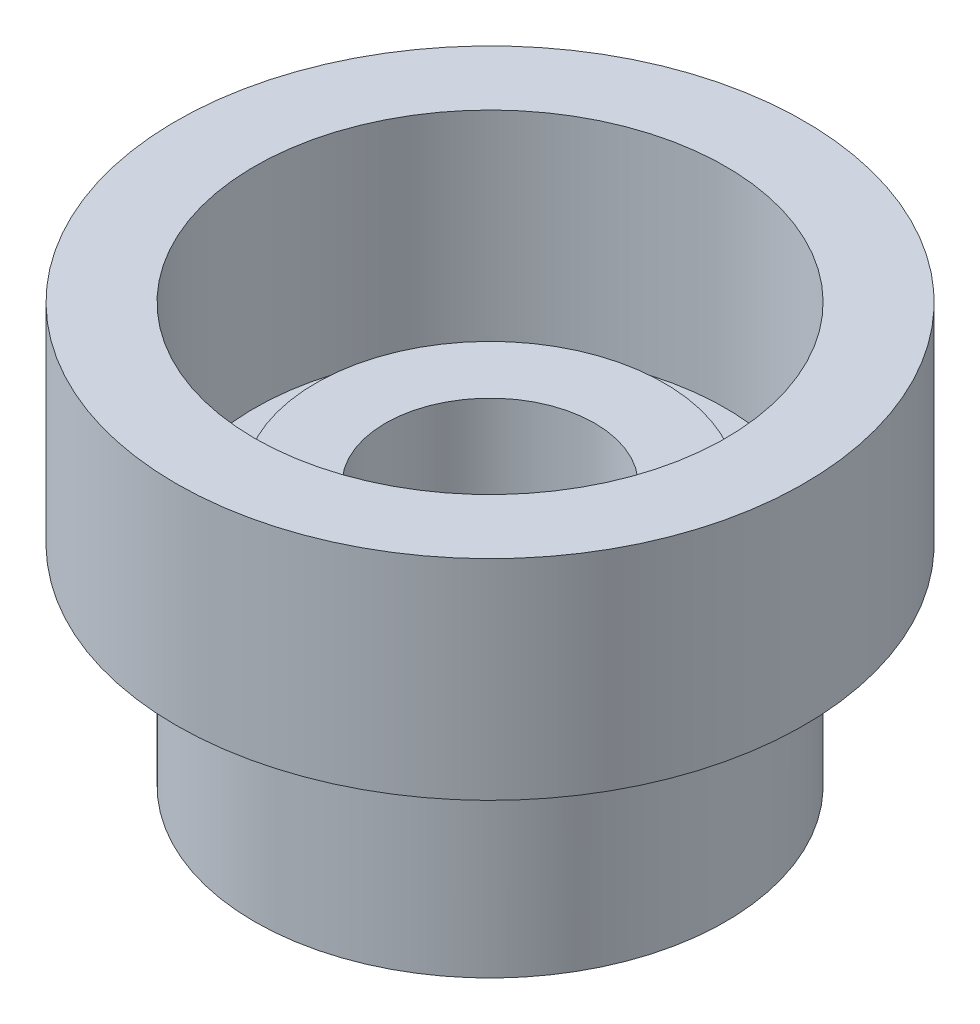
SolidWorks part; units mm, degrees
ref_plane "Front Plane" through (0, 0, 0) normal (0, 0, 1) x (1, 0, 0)
ref_plane "Top Plane" through (0, 0, 0) normal (0, 1, 0) x (1, 0, 0)
ref_plane "Right Plane" through (0, 0, 0) normal (1, 0, 0) x (0, 0, -1)
sketch "Sketch1" plane through (0, 0, 0) normal (0, 1, 0) x (1, 0, 0)
  circle A0 centre (0, 0) radius 152.4
extrude "Extrude1" add sketch "Sketch1" along normal blind 101.6
sketch "Sketch2" plane through (0, 0, 0) normal (0, -1, 0) x (1, 0, 0)
  circle A0 centre (0, 0) radius 114.3
extrude "Extrude2" add sketch "Sketch2" along normal blind 101.6
sketch "Sketch3" plane through (0, -101.6, 0) normal (0, -1, 0) x (1, 0, 0)
  circle A0 centre (0, 0) radius 50.8
extrude "Cut-Extrude1" cut sketch "Sketch3" against normal through all
sketch "Sketch4" plane through (0, 101.6, 0) normal (0, 1, 0) x (-1, 0, 0)
  circle A0 centre (0, 0) radius 114.3
extrude "Cut-Extrude4" cut sketch "Sketch4" against normal blind 101.6
sketch "Sketch5" plane through (0, 0, 0) normal (0, 1, 0) x (-1, 0, 0)
  circle A0 centre (0, 0) radius 50.8
  circle A1 centre (0, 0) radius 84.5356
extrude "Extrude3" add sketch "Sketch5" along normal blind 25.4
